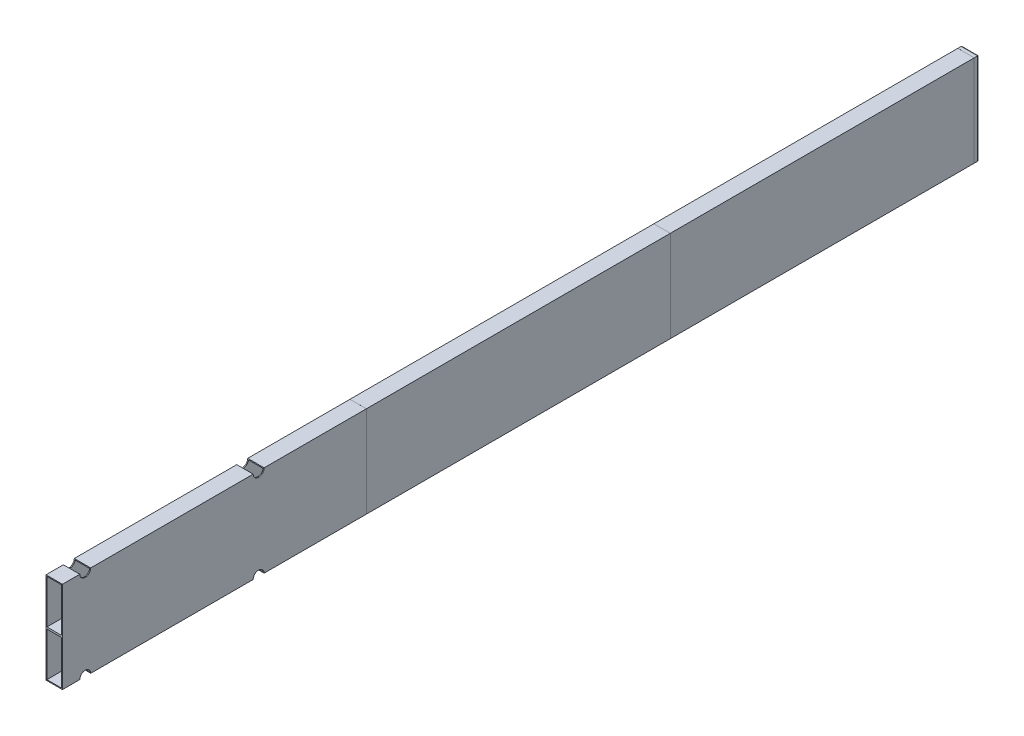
SolidWorks part; units mm, degrees
ref_plane "Plan1" through (0, 0, 0) normal (0, 0, 1) x (1, 0, 0)
ref_plane "Plan2" through (0, 0, 0) normal (0, 1, 0) x (1, 0, 0)
ref_plane "Plan3" through (0, 0, 0) normal (1, 0, 0) x (0, 0, -1)
sketch "Esquisse1" plane through (0, 0, 0) normal (0, 0, 1) x (1, 0, 0)
  line L0 (0, 0) -> (0, 110) construction
  line L1 (-9, 100) -> (9, 100)
  line L2 (-9, 100) -> (-9, 0)
  line L3 (-9, 0) -> (9, 0)
  line L4 (9, 100) -> (9, 0)
  line L5 (-9, 50) -> (30, 50) construction
  line L6 (-8, 49) -> (8, 49)
  line L7 (-8, 99) -> (8, 99)
  line L8 (-8, 99) -> (-8, 51)
  line L9 (-8, 51) -> (8, 51)
  line L10 (8, 99) -> (8, 51)
  line L11 (8, 1) -> (8, 49)
  line L12 (-8, 1) -> (-8, 49)
  line L13 (-8, 1) -> (8, 1)
  point P4 (0, 0)
  dimension "D1" = 100
  dimension "D2" = 18
  dimension "D3" = 16
  dimension "D4" = 48
  dimension "D5" = 1
extrude "Base-Extrusion" add sketch "Esquisse1" against normal blind 333
sketch "Esquisse4" plane through (9, 0, 0) normal (1, 0, 0) x (0, 0, -1)
  line L0 (333, 100) -> (0, 100) construction
  line L1 (333, 0) -> (0, 0) construction
  line L2 (0, 0) -> (0, 100) construction
  circle A0 centre (25, 100) radius 6
  circle A1 centre (215, 100) radius 6
  circle A2 centre (25, 0) radius 6
  circle A3 centre (215, 0) radius 6
  dimension "D1" = 12
  dimension "D2" = 12
  dimension "D3" = 12
  dimension "D4" = 12
  dimension "D6" = 190
  dimension "D5" = 25
extrude "Enlèv. mat.-Extru.1" cut sketch "Esquisse4" against normal through all
sketch "Esquisse7" plane through (0, 0, -333) normal (0, 0, -1) x (-1, 0, 0)
  line L0 (-9, 50) -> (20, 50) construction
  line L1 (-9, 0) -> (-9, 100) construction
  line L2 (0, 0) -> (0, 110) construction
  line L3 (-8, 1) -> (8, 1)
  line L4 (-8, 51) -> (8, 51)
  line L5 (-8, 51) -> (-8, 99)
  line L6 (-8, 99) -> (8, 99)
  line L7 (8, 51) -> (8, 99)
  line L8 (8, 49) -> (8, 1)
  line L9 (-8, 49) -> (8, 49)
  line L10 (-8, 49) -> (-8, 1)
  line L12 (-9.01, 100.01) -> (9.01, 100.01)
  line L13 (-9.01, 100.01) -> (-9.01, -0.01)
  line L14 (-9.01, -0.01) -> (9.01, -0.01)
  line L15 (9.01, 100.01) -> (9.01, -0.01)
  dimension "D1" = 18.02
  dimension "D2" = 100.02
extrude "Boss.-Extru.1" add sketch "Esquisse7" along normal blind 333
sketch "Esquisse8" plane through (0, 0, -666) normal (0, 0, -1) x (-1, 0, 0)
  line L0 (-9.01, 50) -> (20, 50) construction
  line L1 (-9.01, 100.01) -> (-9.01, -0.01) construction
  line L2 (0, 0) -> (0, 110) construction
  line L3 (-8, 1) -> (8, 1)
  line L4 (-8, 51) -> (8, 51)
  line L5 (-8, 51) -> (-8, 99)
  line L6 (-8, 99) -> (8, 99)
  line L7 (8, 51) -> (8, 99)
  line L8 (8, 49) -> (8, 1)
  line L9 (-8, 49) -> (8, 49)
  line L10 (-8, 49) -> (-8, 1)
  line L12 (-9, 100) -> (9, 100)
  line L13 (-9, 100) -> (-9, 0)
  line L14 (-9, 0) -> (9, 0)
  line L15 (9, 100) -> (9, 0)
  dimension "D1" = 18
  dimension "D2" = 100
extrude "Boss.-Extru.2" add sketch "Esquisse8" along normal blind 333
sketch "Esquisse9" plane through (0, 0, -999) normal (0, 0, -1) x (-1, 0, 0)
  line L0 (-9, 50) -> (20, 50) construction
  line L1 (-9.01, 100.01) -> (9.01, 100.01)
  line L2 (-9.01, 100.01) -> (-9.01, -0.01)
  line L3 (-9.01, -0.01) -> (9.01, -0.01)
  line L4 (9.01, 100.01) -> (9.01, -0.01)
  line L5 (-9, 100) -> (-9, 0) construction
  line L6 (0, 0) -> (0, 50) construction
  dimension "D1" = 100.02
  dimension "D2" = 18.02
extrude "Boss.-Extru.3" add sketch "Esquisse9" along normal blind 5
fillet "Congé1" radius 1.5
sketch "Esquisse10" plane through (9.01, 0, 0) normal (1, 0, 0) x (0, 0, -1)
  line L0 (165, 50) -> (999, 50) construction
  line L1 (999, 100.01) -> (999, -0.01) construction
